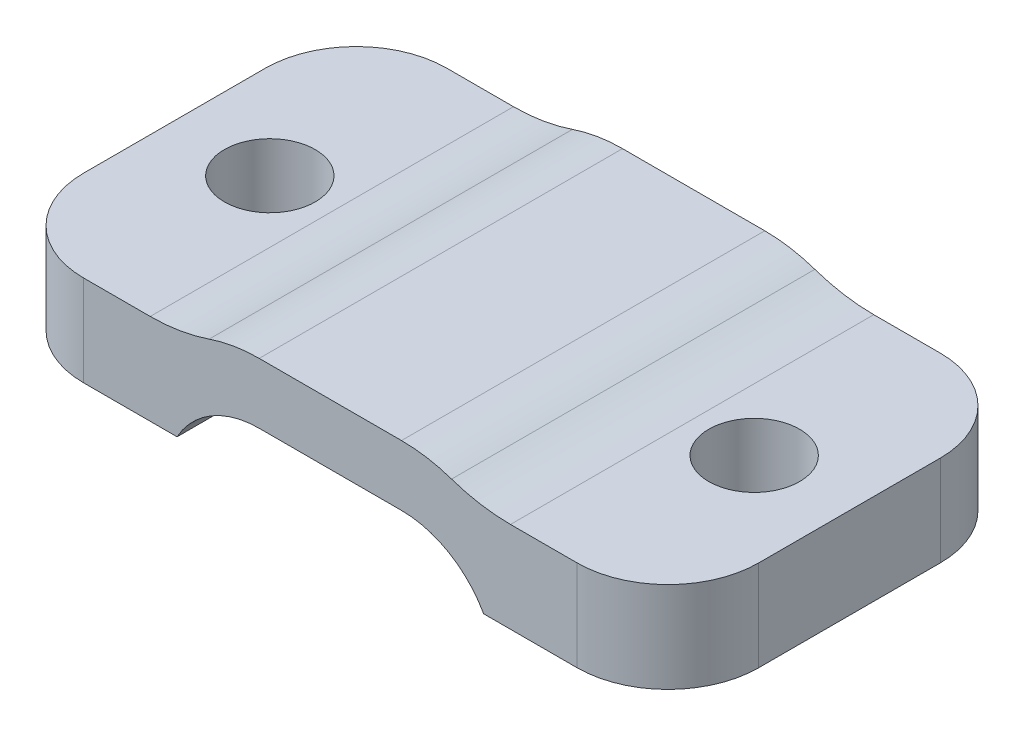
SolidWorks part; units mm, degrees
ref_plane "Front Plane" through (0, 0, 0) normal (0, 0, 1) x (1, 0, 0)
ref_plane "Top Plane" through (0, 0, 0) normal (0, 1, 0) x (1, 0, 0)
ref_plane "Right Plane" through (0, 0, 0) normal (1, 0, 0) x (0, 0, -1)
sketch "Sketch1" plane through (0, 0, 0) normal (0, 0, 1) x (1, 0, 0)
  line L0 (0, 0) -> (4.7, 0) construction
  line L1 (0, 3.1) -> (4.7, 3.1)
  line L2 (0, -3.1) -> (4.7, -3.1)
  line L3 (0, 5.1) -> (4.7, 5.1)
  line L4 (0, -5.1) -> (4.7, -5.1)
  line L5 (2.35, 0) -> (2.35, 1.5) construction
  line L6 (-8.8, 4.5) -> (13.5, 4.5)
  line L7 (-8.8, 4.5) -> (-8.8, 1.5)
  line L8 (-8.8, 1.5) -> (13.5, 1.5)
  line L9 (13.5, 4.5) -> (13.5, 1.5)
  arc A0 (0, 3.1) -> (0, -3.1) centre (0, 0) ccw
  arc A1 (4.7, -3.1) -> (4.7, 3.1) centre (4.7, 0) ccw
  arc A2 (4.7, -5.1) -> (4.7, 5.1) centre (4.7, 0) ccw
  arc A3 (0, 5.1) -> (0, -5.1) centre (0, 0) ccw
  point P3 (2.35, 0)
  dimension "D1" = 4.7
  dimension "D2" = 6.2
  dimension "D4" = 1.5
  dimension "D5" = 22.3
  dimension "D6" = 3
  dimension "D3" = 2
extrude "Boss-Extrude1" add sketch "Sketch1" along normal blind 12 contours A3 L6 L7 L8 | L6 A3 L8 A0 L1 A1 A2 | A2 L8 L9 L6 | L3 A3 L6 A2
fillet "Fillet1" radius 6 2 edges at (7.1, 4.5, 6) (-2.4, 4.5, 6)
sketch "Sketch2" plane through (0, 4.5, 0) normal (0, 1, 0) x (1, 0, 0)
  line L0 (-5.65, -6) -> (10.35, -6) construction
  line L1 (2.35, 0) -> (2.35, -12) construction
  line L2 (0, 0) -> (4.7, 0) construction
  line L3 (0, -12) -> (4.7, -12) construction
  circle A0 centre (-5.65, -6) radius 1.5
  circle A1 centre (10.35, -6) radius 1.5
  point P10 (2.35, -6)
  dimension "D2" = 3
  dimension "D1" = 16
extrude "Cut-Extrude1" cut sketch "Sketch2" against normal through all both and the other way through all
fillet "Fillet2" radius 3 4 edges at (-8.8, 3, 0) (-8.8, 3, 12) (13.5, 3, 0) (13.5, 3, 12)
